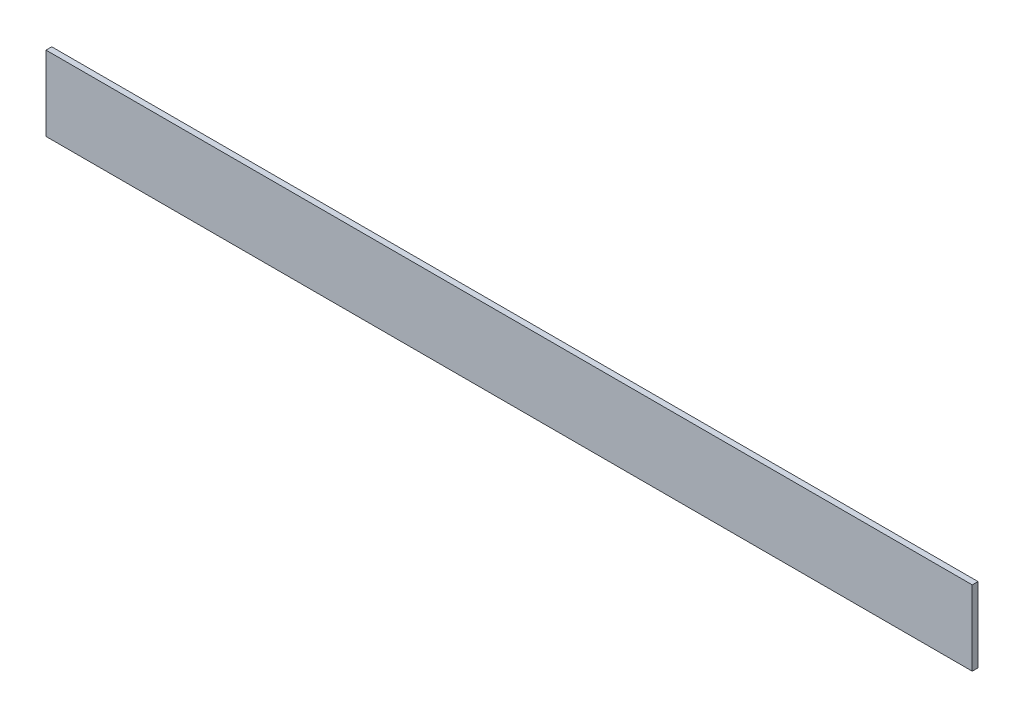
SolidWorks part; units mm, degrees
ref_plane "Front Plane" through (0, 0, 0) normal (0, 0, 1) x (1, 0, 0)
ref_plane "Top Plane" through (0, 0, 0) normal (0, 1, 0) x (1, 0, 0)
ref_plane "Right Plane" through (0, 0, 0) normal (1, 0, 0) x (0, 0, -1)
sketch "Sketch1" plane through (0, 0, 0) normal (0, 0, 1) x (1, 0, 0)
  line L1 (0, 0) -> (161, 0)
  line L2 (0, 0) -> (0, 13)
  line L3 (0, 13) -> (161, 13)
  line L4 (161, 0) -> (161, 13)
  dimension "D1" = 161
  dimension "D2" = 13
extrude "Boss-Extrude1" add sketch "Sketch1" along normal blind 1
